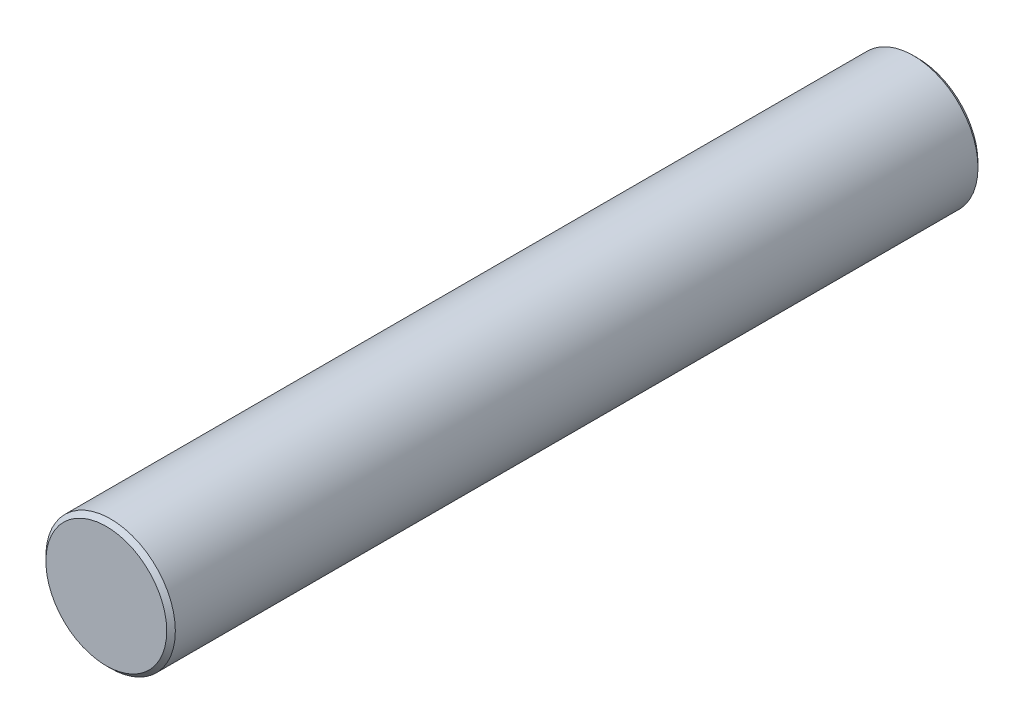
SolidWorks part; units mm, degrees
ref_plane "Plan de face" through (0, 0, 0) normal (0, 0, 1) x (1, 0, 0)
ref_plane "Plan de dessus" through (0, 0, 0) normal (0, 1, 0) x (1, 0, 0)
ref_plane "Plan de droite" through (0, 0, 0) normal (1, 0, 0) x (0, 0, -1)
sketch "Esquisse1" plane through (0, 0, 0) normal (0, 0, 1) x (1, 0, 0)
  circle A0 centre (0, 0) radius 3
  dimension "D1" = 6
extrude "corps" add sketch "Esquisse1" along normal blind 37.6
hole_wizard "Trou taraudé M31" positions "Esquisse3" profile "Esquisse2" tap size "M3" standard "Iso"
sketch "Esquisse3" plane through (0, 0, 0) normal (0, 0, -1) x (-1, 0, 0)
  point P0 (0, 0)
sketch "Esquisse2" plane through (0, 0, 0) normal (1, 0, 0) x (0, 1, 0)
  line L0 (0, 0) -> (0, 8.2511)
  line L1 (0, 8.2511) -> (1.25, 7.5)
  line L2 (1.25, 7.5) -> (1.25, 0)
  line L5 (1.25, 0) -> (0, 0)
  line L10 (0, 8.2511) -> (-1.25, 7.5) construction
  line L11 (0, -6.35) -> (0, 107.95) construction
  dimension "Diamètre du trou pour taraudage" = 2.5
  dimension "Profondeur du trou pour taraudage" = 7.5
  dimension "Angle de pointe" = 118
chamfer "Chanfrein1" distance 0.2 angle 45 2 edges at (3, 0, 37.6) (3, 0, 0)
